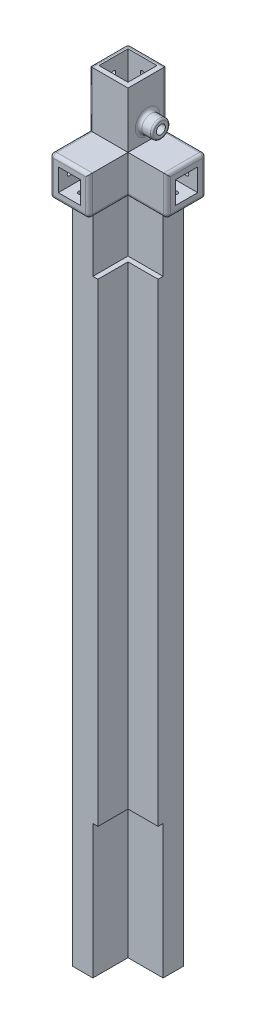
SolidWorks part; units mm, degrees
ref_plane "Alzado" through (0, 0, 0) normal (0, 0, 1) x (1, 0, 0)
ref_plane "Planta" through (0, 0, 0) normal (0, 1, 0) x (1, 0, 0)
ref_plane "Vista lateral" through (0, 0, 0) normal (1, 0, 0) x (0, 0, -1)
sketch "Sketch1" plane through (0, 0, 0) normal (0, 0, 1) x (1, 0, 0)
  line L0 (0, 85) -> (0, 0)
  line L1 (0, 0) -> (70, 0)
  line L2 (70, 0) -> (70, 35)
  line L3 (70, 35) -> (35, 35)
  line L4 (35, 35) -> (35, 85)
  line L5 (35, 85) -> (0, 85)
  dimension "D1" = 85
  dimension "D2" = 70
  dimension "D3" = 35
  dimension "D4" = 35
extrude "Boss-Extrude1" add sketch "Sketch1" along normal blind 35
sketch "Sketch4" plane through (70, 0, 0) normal (1, 0, 0) x (0, 0, -1)
  line L0 (0, 0) -> (0, 35) construction
  line L1 (-27.5, 27.5) -> (-7.5, 27.5)
  line L2 (-27.5, 27.5) -> (-27.5, 7.5)
  line L3 (-27.5, 7.5) -> (-7.5, 7.5)
  line L4 (-7.5, 27.5) -> (-7.5, 7.5)
  line L5 (-27.5, 27.5) -> (-7.5, 7.5) construction
  line L6 (-27.5, 7.5) -> (-7.5, 27.5) construction
  line L7 (-35, 0) -> (0, 0) construction
  point P0 (-17.5, 17.5)
  dimension "D1" = 20
  dimension "D2" = 20
  dimension "D3" = 17.5
  dimension "D4" = 17.5
sketch "Sketch5" plane through (0, 85, 0) normal (0, 1, 0) x (1, 0, 0)
  line L0 (35, 0) -> (0, 0) construction
  line L1 (4.5, -4.5) -> (30.5, -4.5)
  line L2 (4.5, -4.5) -> (4.5, -30.5)
  line L3 (4.5, -30.5) -> (30.5, -30.5)
  line L4 (30.5, -4.5) -> (30.5, -30.5)
  line L5 (4.5, -4.5) -> (30.5, -30.5) construction
  line L6 (4.5, -30.5) -> (30.5, -4.5) construction
  line L7 (35, -35) -> (35, 0) construction
  point P0 (17.5, -17.5)
  dimension "D1" = 26
  dimension "D2" = 26
  dimension "D3" = 17.5
  dimension "D4" = 17.5
sketch "Sketch8" plane through (0, 0, 35) normal (0, 0, 1) x (1, 0, 0)
  line L1 (0, 0) -> (35, 0)
  line L2 (0, 0) -> (0, 35)
  line L3 (0, 35) -> (35, 35)
  line L4 (35, 0) -> (35, 35)
extrude "Boss-Extrude2" add sketch "Sketch8" along normal blind 35
sketch "Sketch9" plane through (0, 0, 70) normal (0, 0, 1) x (1, 0, 0)
  line L0 (0, 35) -> (0, 0) construction
  line L1 (7.5, 27.5) -> (27.5, 27.5)
  line L2 (7.5, 27.5) -> (7.5, 7.5)
  line L3 (7.5, 7.5) -> (27.5, 7.5)
  line L4 (27.5, 27.5) -> (27.5, 7.5)
  line L5 (7.5, 27.5) -> (27.5, 7.5) construction
  line L6 (7.5, 7.5) -> (27.5, 27.5) construction
  line L8 (0, 0) -> (35, 0) construction
  point P0 (17.5, 17.5)
  dimension "D1" = 20
  dimension "D2" = 20
  dimension "D3" = 17.5
  dimension "D4" = 17.5
extrude "Cut-Extrude1" cut sketch "Sketch9" against normal blind 20
extrude "Cut-Extrude2" cut sketch "Sketch4" against normal blind 20
sketch "Sketch10" plane through (35, 0, 0) normal (1, 0, 0) x (0, 0, -1)
  line L0 (-35, 35) -> (-35, 85) construction
  line L1 (-4.5, 85) -> (-30.5, 85) construction
  circle A0 centre (-17.5, 50) radius 8
  dimension "D1" = 16
  dimension "D2" = 17.5
  dimension "D3" = 35
extrude "Boss-Extrude3" add sketch "Sketch10" along normal blind 12
sketch "Sketch11" plane through (47, 0, 0) normal (1, 0, 0) x (0, 0, -1)
  circle A0 centre (-17.5, 50) radius 4
  dimension "D1" = 8
extrude "Cut-Extrude3" cut sketch "Sketch11" against normal blind 25
extrude "Cut-Extrude4" cut sketch "Sketch5" against normal blind 25
sketch "Sketch12" plane through (0, 0, 0) normal (-1, 0, 0) x (0, 0, 1)
  line L0 (0, 85) -> (0, 0) construction
  line L1 (35, 85) -> (0, 85) construction
  line L2 (70, 35) -> (70, 0) construction
  line L3 (70, 35) -> (35, 35) construction
  circle A0 centre (17.5, 72.5) radius 2
  circle A1 centre (60, 17.5) radius 2
  dimension "D1" = 4
  dimension "D2" = 4
  dimension "D3" = 17.5
  dimension "D4" = 12.5
  dimension "D5" = 10
  dimension "D6" = 17.5
extrude "Cut-Extrude5" cut sketch "Sketch12" against normal blind 10
sketch "Sketch13" plane through (0, 0, 0) normal (0, 0, -1) x (-1, 0, 0)
  line L0 (-70, 0) -> (-70, 35) construction
  line L1 (-35, 35) -> (-35, 85) construction
  line L2 (-35, 85) -> (0, 85) construction
  line L3 (-70, 35) -> (-35, 35) construction
  circle A0 centre (-17.5, 72.5) radius 2
  circle A1 centre (-60, 17.5) radius 2
  dimension "D1" = 4
  dimension "D2" = 4
  dimension "D3" = 10
  dimension "D4" = 17.5
  dimension "D5" = 12.5
  dimension "D6" = 17.5
extrude "Cut-Extrude6" cut sketch "Sketch13" against normal blind 10
sketch "Sketch14" plane through (0, 0, 0) normal (0, -1, 0) x (1, 0, 0)
  line L0 (0, 70) -> (35, 70) construction
  line L3 (70, 35) -> (70, 0) construction
  line L4 (0, 0) -> (70, 0) construction
  line L5 (35, 70) -> (35, 35) construction
  circle A0 centre (17.5, 60) radius 2
  circle A1 centre (60, 17.5) radius 2
  dimension "D5" = 4
  dimension "D6" = 4
  dimension "D1" = 10
  dimension "D2" = 10
  dimension "D3" = 17.5
  dimension "D4" = 17.5
extrude "Cut-Extrude7" cut sketch "Sketch14" against normal blind 10
fillet "Fillet1" radius 3 19 edges at (17.5, 85, 0) (17.5, 0, 70) (17.5, 35, 70) (35, 17.5, 70) (35, 0, 52.5) (52.5, 0, 35) (70, 17.5, 35) (70, 35, 17.5) (70, 0, 17.5) (35, 0, 0) (70, 17.5, 0) (52.5, 35, 0) (35, 60, 0) (0, 85, 17.5) (0, 42.5, 0) (0, 60, 35) (0, 35, 52.5) (0, 17.5, 70) (0, 0, 35)
fillet "Fillet2" radius 3 1 edges at (35, 50, 25.5)
fillet "Fillet3" radius 1.5 1 edges at (47, 50, 9.5)
sketch "Sketch15" plane through (0, 0, 0) normal (0, -1, 0) x (1, 0, 0)
  line L0 (-23, 27) -> (-23, 0)
  line L1 (0, 3) -> (0, 67) construction
  line L2 (27, -23) -> (0, -23)
  line L4 (0, 27) -> (0, 0)
  line L5 (0, 0) -> (27, 0)
  line L6 (27, 0) -> (27, -23)
  line L7 (-23, 27) -> (0, 27)
  arc A0 (-23, 0) -> (0, -23) centre (0, 0) ccw
  dimension "D1" = 23
  dimension "D2" = 27
  dimension "D3" = 27
extrude "Boss-Extrude4" add sketch "Sketch15" along normal blind 630 separate body
sketch "Sketch16" plane through (0, 0, 27) normal (0, 0, 1) x (1, 0, 0)
  line L1 (0, 0) -> (-4.5, 0)
  line L2 (0, 0) -> (0, -85)
  line L3 (0, -85) -> (-4.5, -85)
  line L4 (-4.5, 0) -> (-4.5, -85)
  dimension "D1" = 85
  dimension "D2" = 4.5
extrude "Cut-Extrude8" cut sketch "Sketch16" against normal up to surface (27 mm away) contours L4 L3 L2 L1
sketch "Sketch17" plane through (27, 0, 0) normal (1, 0, 0) x (0, 0, -1)
  line L1 (0, 0) -> (4.5, 0)
  line L2 (0, 0) -> (0, -85)
  line L3 (0, -85) -> (4.5, -85)
  line L4 (4.5, 0) -> (4.5, -85)
  dimension "D1" = 85
  dimension "D2" = 4.5
extrude "Cut-Extrude9" cut sketch "Sketch17" against normal up to surface (31.5 mm away)
sketch "Sketch18" plane through (27, 0, 0) normal (1, 0, 0) x (0, 0, -1)
  line L1 (0, -630) -> (4.5, -630)
  line L2 (0, -630) -> (0, -510)
  line L3 (0, -510) -> (4.5, -510)
  line L4 (4.5, -630) -> (4.5, -510)
extrude "Cut-Extrude10" cut sketch "Sketch18" against normal up to surface (27 mm away)
sketch "Sketch19" plane through (0, 0, 27) normal (0, 0, 1) x (1, 0, 0)
  line L1 (0, -630) -> (-4.5, -630)
  line L2 (0, -630) -> (0, -510)
  line L3 (0, -510) -> (-4.5, -510)
  line L4 (-4.5, -630) -> (-4.5, -510)
extrude "Cut-Extrude11" cut sketch "Sketch19" against normal up to surface (31.5 mm away)
